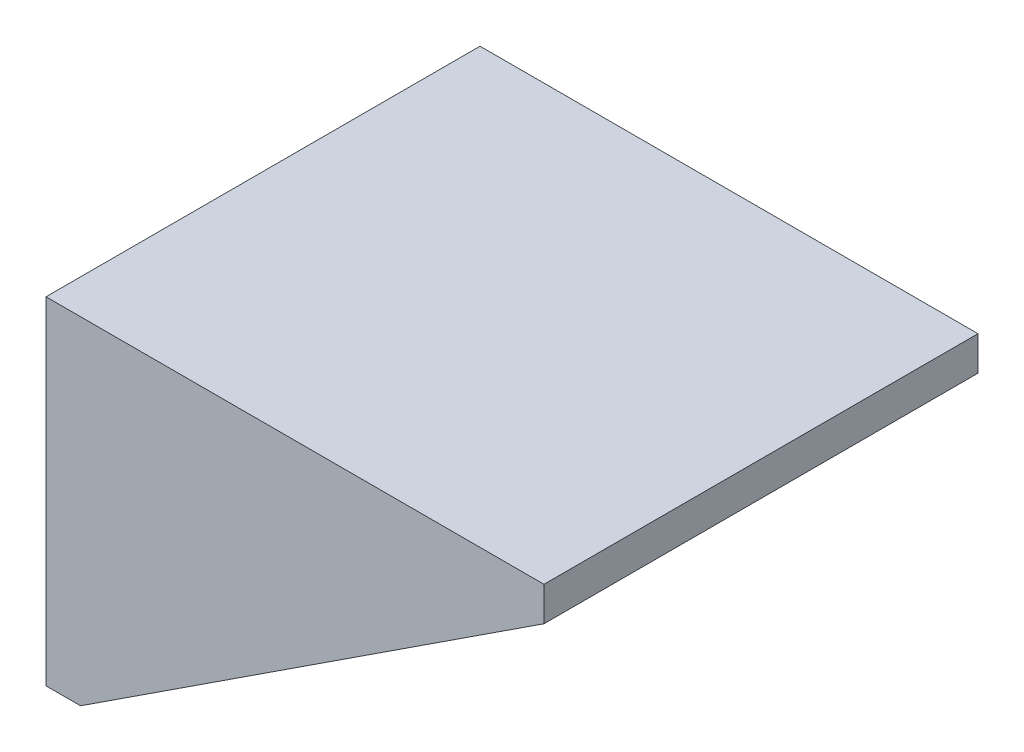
SolidWorks part; units mm, degrees
ref_plane "Front Plane" through (0, 0, 0) normal (0, 0, 1) x (1, 0, 0)
ref_plane "Top Plane" through (0, 0, 0) normal (0, 1, 0) x (1, 0, 0)
ref_plane "Right Plane" through (0, 0, 0) normal (1, 0, 0) x (0, 0, -1)
sketch "Sketch1" plane through (0, 0, 0) normal (0, 0, 1) x (1, 0, 0)
  line L0 (29.1423, 110.7922) -> (2.0205, 93.0742)
  line L1 (0, 93.0742) -> (2.0205, 93.0742)
  line L2 (0, 93.0742) -> (0, 112.7945)
  line L3 (0, 112.7945) -> (29.1423, 112.7945)
  line L4 (29.1423, 110.7922) -> (29.1423, 112.7945)
extrude "Boss-Extrude1" add sketch "Sketch1" along normal blind 25.4
